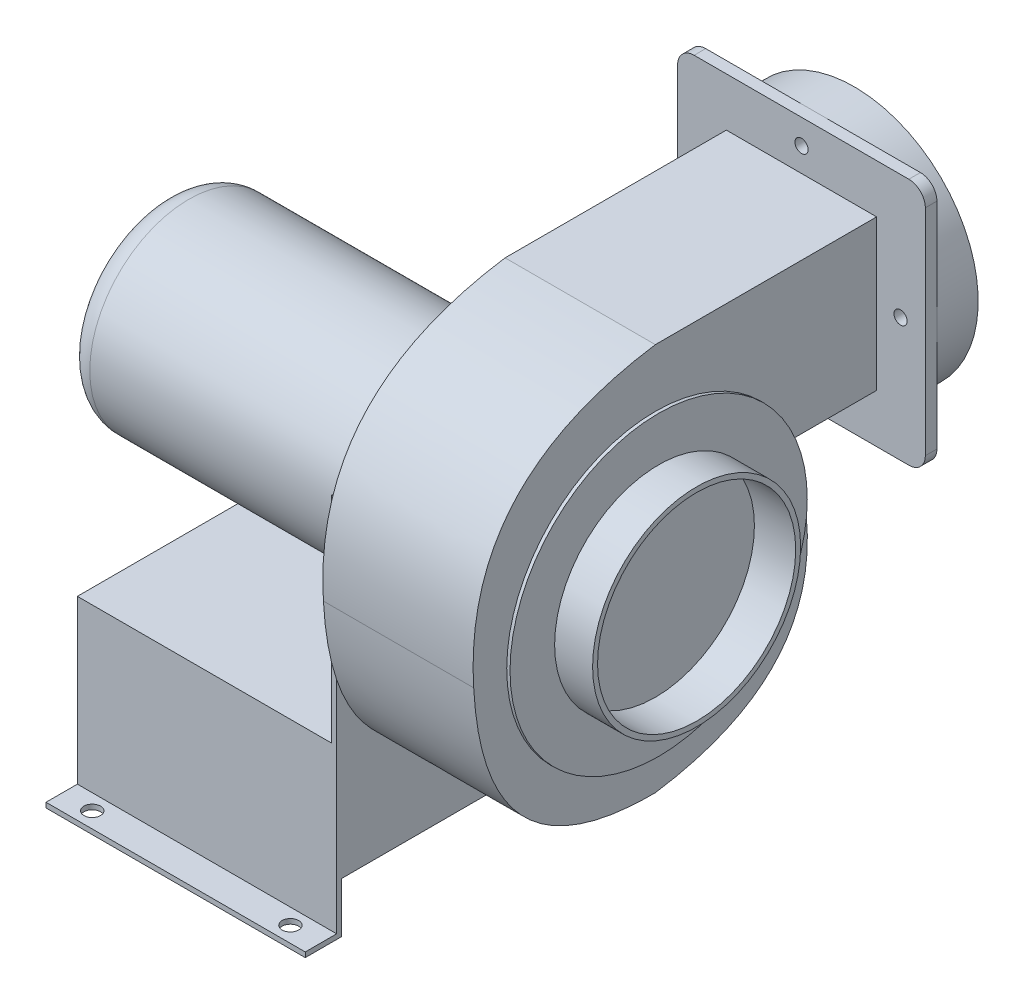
SolidWorks part; units mm, degrees
ref_plane "前视基准面" through (0, 0, 0) normal (0, 0, 1) x (1, 0, 0)
ref_plane "上视基准面" through (0, 0, 0) normal (0, 1, 0) x (1, 0, 0)
ref_plane "右视基准面" through (0, 0, 0) normal (1, 0, 0) x (0, 0, -1)
sketch "草图1" plane through (0, 0, 0) normal (1, 0, 0) x (0, 0, -1)
  line L3 (0, 125) -> (134, 125)
  line L4 (134, 125) -> (134, 34)
  line L5 (134, 34) -> (83.3307, 34)
  arc A0 (90, 0) -> (83.3307, 34) centre (0, 0) ccw
  spline S0 degree 2 poles (0, 125) (-116.6463, 107.4753) (-110, 0) knots 0 0 0 1 1 1
  spline S1 degree 2 poles (-110, 0) (-103.95, -110.8769) (0, -110) knots 0 0 0 1 1 1
  spline S2 degree 2 poles (0, -110) (105.8356, -94.3113) (90, 0) knots 0 0 0 1 1 1
extrude "凸台-拉伸1" add sketch "草图1" along normal blind 91
sketch "草图3" plane through (0, 0, -134) normal (0, 0, -1) x (-1, 0, 0)
  line L4 (-110.5, 4.5) -> (19.5, 4.5)
  line L5 (-120.5, 14.5) -> (-120.5, 144.5)
  line L6 (-110.5, 154.5) -> (19.5, 154.5)
  line L7 (29.5, 14.5) -> (29.5, 144.5)
  line L8 (-120.5, 4.5) -> (29.5, 154.5) construction
  line L9 (-120.5, 154.5) -> (29.5, 4.5) construction
  arc A0 (-120.5, 144.5) -> (-110.5, 154.5) centre (-110.5, 144.5) cw
  arc A1 (-110.5, 4.5) -> (-120.5, 14.5) centre (-110.5, 14.5) cw
  arc A2 (19.5, 4.5) -> (29.5, 14.5) centre (19.5, 14.5) ccw
  arc A3 (19.5, 154.5) -> (29.5, 144.5) centre (19.5, 144.5) cw
  point P6 (-45.5, 79.5)
  dimension "D1" = 10
extrude "凸台-拉伸2" add sketch "草图3" along normal blind 7
sketch "草图4" plane through (0, 0, -141) normal (0, 0, -1) x (-1, 0, 0)
  circle A1 centre (-45.5, 139.5) radius 4
  circle A2 centre (14.5, 79.5) radius 4
  circle A3 centre (-45.5, 19.5) radius 4
  circle A4 centre (-105.5, 79.5) radius 4
extrude "切除-拉伸1" cut sketch "草图4" against normal blind 7
sketch "草图5" plane through (0, 0, -141) normal (0, 0, -1) x (-1, 0, 0)
  line L4 (-90.5, 34.5) -> (-0.5, 34.5)
  line L5 (-90.5, 34.5) -> (-90.5, 124.5)
  line L6 (-90.5, 124.5) -> (-0.5, 124.5)
  line L7 (-0.5, 34.5) -> (-0.5, 124.5)
  line L8 (-90.5, 34.5) -> (-0.5, 124.5) construction
  line L9 (-90.5, 124.5) -> (-0.5, 34.5) construction
  point P6 (-45.5, 79.5)
extrude "切除-拉伸2" cut sketch "草图5" against normal blind 120
sketch "草图6" plane through (0, 0, -141) normal (0, 0, -1) x (-1, 0, 0)
  circle A0 centre (-45.5, 79.5) radius 75
  circle A1 centre (-45.5, 79.5) radius 72
extrude "凸台-拉伸3" add sketch "草图6" along normal blind 25
sketch "草图7" plane through (91, 0, 0) normal (1, 0, 0) x (0, 0, -1)
  circle A0 centre (0, 0) radius 90
  circle A1 centre (0, 0) radius 60
extrude "凸台-拉伸4" add sketch "草图7" along normal blind 2
sketch "草图8" plane through (93, 0, 0) normal (1, 0, 0) x (0, 0, -1)
  circle A0 centre (0, 0) radius 60
  circle A1 centre (0, 0) radius 63
extrude "凸台-拉伸5" add sketch "草图8" along normal blind 23
sketch "草图9" plane through (0, 0, 0) normal (-1, 0, 0) x (0, 0, 1)
  circle A0 centre (0, 0) radius 60
extrude "凸台-拉伸6" add sketch "草图9" along normal blind 206.5
fillet "圆角1" radius 15 1 edges at (-206.5, 0, 60)
sketch "草图11" plane through (0, 0, 0) normal (-1, 0, 0) x (0, 0, 1)
  line L0 (-102, 50) -> (-33.1662, 50)
  line L1 (33.1662, 50) -> (102, 50)
  line L3 (-102, 50) -> (-102, -151)
  line L4 (-102, -151) -> (102, -151)
  line L5 (102, -151) -> (102, 50)
  arc A2 (-33.1662, 50) -> (33.1662, 50) centre (0, 0) ccw
extrude "凸台-拉伸7" add sketch "草图11" along normal blind 3
sketch "草图14" plane through (-3, 0, 0) normal (-1, 0, 0) x (0, 0, 1)
  line L2 (-102, 50) -> (-102, -151) construction
  line L3 (-102, -80) -> (-102, -83)
  line L4 (-102, -83) -> (102, -83)
  line L5 (102, -151) -> (102, 50) construction
  line L6 (102, -83) -> (102, -80)
  line L7 (102, -80) -> (-102, -80)
extrude "凸台-拉伸10" add sketch "草图14" along normal blind 154
sketch "草图20" plane through (0, -83, 0) normal (0, -1, 0) x (1, 0, 0)
  line L0 (-3, 102) -> (-157, 102)
  line L1 (-157, 102) -> (-157, 99)
  line L2 (-157, -102) -> (-157, 102) construction
  line L3 (-157, 99) -> (-3, 99)
  line L4 (-3, -102) -> (-3, 102) construction
  line L5 (-3, 99) -> (-3, 102)
  line L6 (-157, -102) -> (-3, -102)
  line L7 (-3, -102) -> (-3, -99)
  line L8 (-3, -102) -> (-3, 102) construction
  line L9 (-3, -99) -> (-157, -99)
  line L10 (-157, -99) -> (-157, -102)
extrude "凸台-拉伸14" add sketch "草图20" along normal blind 68
sketch "草图23" plane through (0, -151, 0) normal (0, -1, 0) x (-1, 0, 0)
  line L0 (157, -102) -> (157, -99)
  line L1 (157, -99) -> (0, -99)
  line L2 (0, 0) -> (0, -102) construction
  line L3 (0, -99) -> (0, -102)
  line L4 (0, -102) -> (157, -102)
  line L5 (157, 99) -> (157, 102)
  line L6 (157, 102) -> (0, 102)
  line L7 (0, 102) -> (0, 99)
  line L8 (0, 83.3307) -> (0, 102) construction
  line L9 (0, 99) -> (157, 99)
extrude "凸台-拉伸15" add sketch "草图23" along normal blind 27.5
sketch "草图24" plane through (0, -178.5, 0) normal (0, -1, 0) x (1, 0, 0)
  line L0 (-157, 99) -> (-157, 121)
  line L1 (-157, 121) -> (0, 121)
  line L2 (0, 121) -> (0, 99)
  line L3 (0, 99) -> (-157, 99)
  line L4 (-157, -99) -> (-157, -121)
  line L5 (-157, -121) -> (0, -121)
  line L6 (0, -102) -> (0, -134) construction
  line L7 (0, -121) -> (0, -99)
  line L8 (0, -99) -> (-157, -99)
extrude "凸台-拉伸16" add sketch "草图24" along normal blind 3
sketch "草图29" plane through (0, -181.5, 0) normal (0, -1, 0) x (1, 0, 0)
  circle A0 centre (-138.5, 111.5) radius 5
  circle A1 centre (-18.5, 111.5) radius 5
  circle A2 centre (-18.5, -111.5) radius 5
  circle A3 centre (-138.5, -111.5) radius 5
extrude "切除-拉伸3" cut sketch "草图29" against normal blind 3
